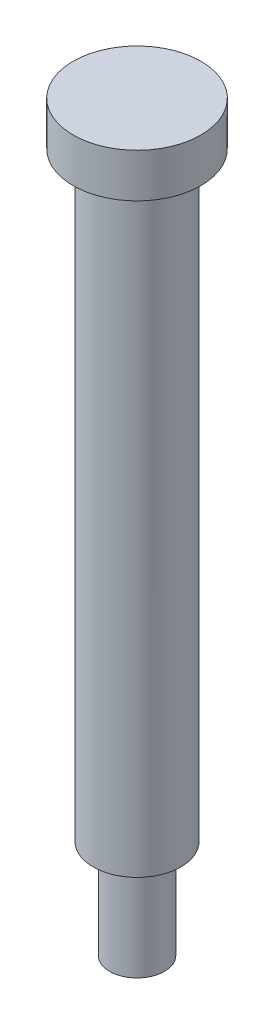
SolidWorks part; units mm, degrees
ref_plane "Front" through (0, 0, 0) normal (0, 0, 1) x (1, 0, 0)
ref_plane "Top" through (0, 0, 0) normal (0, 1, 0) x (1, 0, 0)
ref_plane "Right" through (0, 0, 0) normal (1, 0, 0) x (0, 0, -1)
sketch "Sketch1" plane through (0, 0, 0) normal (0, 0, 1) x (1, 0, 0)
  line L0 (0, 1018.7642) -> (0, 801.2767) construction
  line L1 (0, 801.2767) -> (-12.7, 801.2767) construction
  line L2 (-12.7, 801.2767) -> (-12.7, 1003.5242) construction
  line L3 (-18.4944, 1003.5242) -> (0, 1003.5242) construction
  line L4 (-18.4944, 1016.2242) -> (-18.4944, 942.5642) construction
  line L5 (-18.4944, 1016.2242) -> (0, 1016.2242) construction
  line L6 (0, 1016.2242) -> (0, 801.2767)
  line L7 (0, 801.2767) -> (-12.7, 801.2767)
  line L8 (-12.7, 801.2767) -> (-12.7, 1003.5242)
  line L9 (-18.4944, 1003.5242) -> (-12.7, 1003.5242)
  line L10 (-18.4944, 1016.2242) -> (-18.4944, 1003.5242)
  line L11 (-18.4944, 1016.2242) -> (0, 1016.2242)
  line L12 (0, 842.5517) -> (0, 942.5642) construction
  line L13 (0, 842.5517) -> (0, 942.5642) construction
revolve "Base-Revolve" add sketch "Sketch1" angle 360 about L13
sketch "Sketch2" plane through (0, 0, 0) normal (0, 0, 1) x (1, 0, 0)
  line L0 (0, 1018.7642) -> (0, 801.2767) construction
  line L1 (0, 1018.7642) -> (0, 801.2767) construction
  line L2 (0, 801.2767) -> (-12.7, 801.2767) construction
  line L3 (-12.7, 801.2767) -> (-12.7, 1003.5242) construction
  line L4 (-7.9375, 829.8517) -> (-12.7, 829.8517) construction
  line L5 (-7.9375, 827.9213) -> (-7.9375, 801.2767) construction
  line L6 (-7.9375, 801.2767) -> (-12.7, 801.2767)
  line L7 (-12.7, 801.2767) -> (-12.7, 829.8517)
  line L8 (-7.9375, 829.8517) -> (-12.7, 829.8517)
  line L9 (-7.9375, 827.9213) -> (-7.9375, 801.2767)
  line L10 (-7.1501, 829.0643) -> (-7.1501, 828.7087) construction
  line L11 (-7.1501, 829.0643) -> (-7.1501, 828.7087)
  arc A0 (-7.1501, 829.0643) -> (-7.9375, 829.8517) centre (-7.9375, 829.0643) ccw construction
  arc A1 (-7.9375, 827.9213) -> (-7.1501, 828.7087) centre (-7.9375, 828.7087) ccw construction
  arc A2 (-7.1501, 829.0643) -> (-7.9375, 829.8517) centre (-7.9375, 829.0643) ccw
  arc A3 (-7.9375, 827.9213) -> (-7.1501, 828.7087) centre (-7.9375, 828.7087) ccw
revolve "5/8-18 UNF-2A" cut sketch "Sketch2" angle 360 about L1
